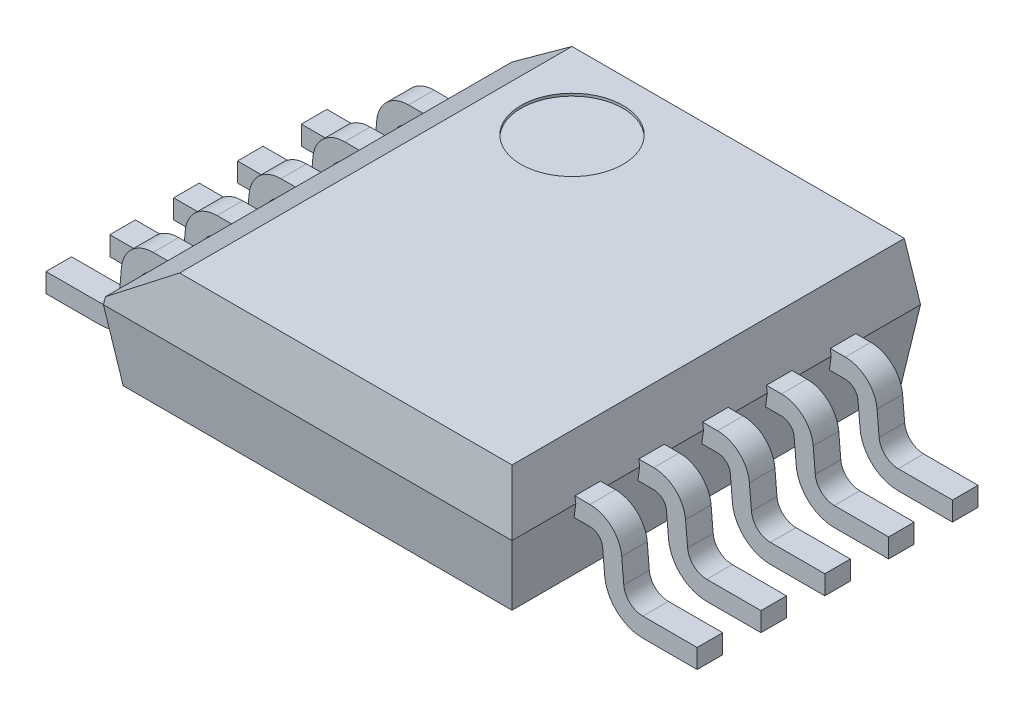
SolidWorks part; units mm, degrees
ref_plane "Front" through (0, 0, 0) normal (0, 0, 1) x (1, 0, 0)
ref_plane "Top" through (0, 0, 0) normal (0, 1, 0) x (1, 0, 0)
ref_plane "Right" through (0, 0, 0) normal (1, 0, 0) x (0, 0, -1)
ref_plane "ПлоскостьВывод1" through (0, 0, -1) normal (0, 0, 1) x (1, 0, 0)
sketch "ЭскизВывод1" plane through (0, 0, -1) normal (0, 0, 1) x (1, 0, 0)
  line L0 (-2.55, 0) -> (-2.1249, 0)
  line L1 (-1.826, 0.2739) -> (-1.8099, 0.4587)
  line L2 (-1.7102, 0.55) -> (1.7102, 0.55)
  line L3 (0, 0.55) -> (0, 0) construction
  line L4 (1.826, 0.2739) -> (1.8099, 0.4587)
  line L5 (2.55, 0) -> (2.1249, 0)
  arc A0 (-1.8099, 0.4587) -> (-1.7102, 0.55) centre (-1.7102, 0.45) cw
  arc A1 (-2.1249, 0) -> (-1.826, 0.2739) centre (-2.1249, 0.3) ccw
  arc A2 (2.1249, 0) -> (1.826, 0.2739) centre (2.1249, 0.3) cw
  arc A3 (1.8099, 0.4587) -> (1.7102, 0.55) centre (1.7102, 0.45) ccw
  point P8 (-1.8019, 0.55)
  point P11 (-1.85, 0)
  dimension "D6" = 0.1
  dimension "D7" = 0.3
  dimension "E" = 5.1
  dimension "A_mid_lead" = 0.55
  dimension "L" = 0.7
  dimension "D4" = 85
  dimension "D5" = 3.6038
extrude "Вывод1" add sketch "ЭскизВывод1" along normal mid plane 0.2 thin
ref_plane "ПлоскостьКорпус" through (0, 0.65, 0) normal (0, 1, 0) x (-1, 0, 0)
sketch "ЭскизКорпус" plane through (0, 0.65, 0) normal (0, 1, 0) x (1, 0, 0)
  line L1 (1.6, -1.6) -> (-1.6, -1.6)
  line L2 (1.6, -1.6) -> (1.6, 1.6)
  line L3 (1.6, 1.6) -> (-1.6, 1.6)
  line L4 (-1.6, -1.6) -> (-1.6, 1.6)
  line L5 (1.6, -1.6) -> (-1.6, 1.6) construction
  line L6 (1.6, 1.6) -> (-1.6, -1.6) construction
  point P0 (0, 0)
  dimension "D" = 3.2
  dimension "E" = 3.2
extrude "Корпус" add sketch "ЭскизКорпус" along normal offset from surface 1.1 draft 8 and the other way offset from surface (0.55 mm away) 0.1 draft 8
pattern_linear "Выводы" count 5 spacing 0.5 along (0, 0, 1) of "Вывод1"
chamfer "Фаска1" distance 0.4 angle 45 1 edges at (-1.5368, 1.1, 0)
sketch "Эскиз3" plane through (0, 1.1, 0) normal (0, 1, 0) x (1, 0, 0)
  line L0 (-1.0668, 0.9368) -> (-0.4668, 0.9368) construction
  line L1 (-1.0668, 1.5368) -> (-1.0668, -1.5368) construction
  line L2 (-0.4668, 0.9368) -> (-0.4668, 1.5368) construction
  line L3 (1.5368, 1.5368) -> (-1.0668, 1.5368) construction
  circle A0 centre (-0.4668, 0.9368) radius 0.4
  dimension "D2" = 0.8
  dimension "D1" = 0.6
extrude "Вытянуть3" cut sketch "Эскиз3" against normal blind 0.02
sketch "SkThermalPad" plane through (0, 0.65, 0) normal (0, 1, 0) x (-1, 0, 0)
  line L1 (1.25, 1.25) -> (-1.25, 1.25)
  line L2 (1.25, 1.25) -> (1.25, -1.25)
  line L3 (1.25, -1.25) -> (-1.25, -1.25)
  line L4 (-1.25, 1.25) -> (-1.25, -1.25)
  line L5 (1.25, 1.25) -> (-1.25, -1.25) construction
  line L6 (1.25, -1.25) -> (-1.25, 1.25) construction
  point P0 (0, 0)
  dimension "D1" = 2.5
  dimension "E2" = 2.5
extrude "ThermalPad" add sketch "SkThermalPad" against normal up to surface (0.65 mm away)
